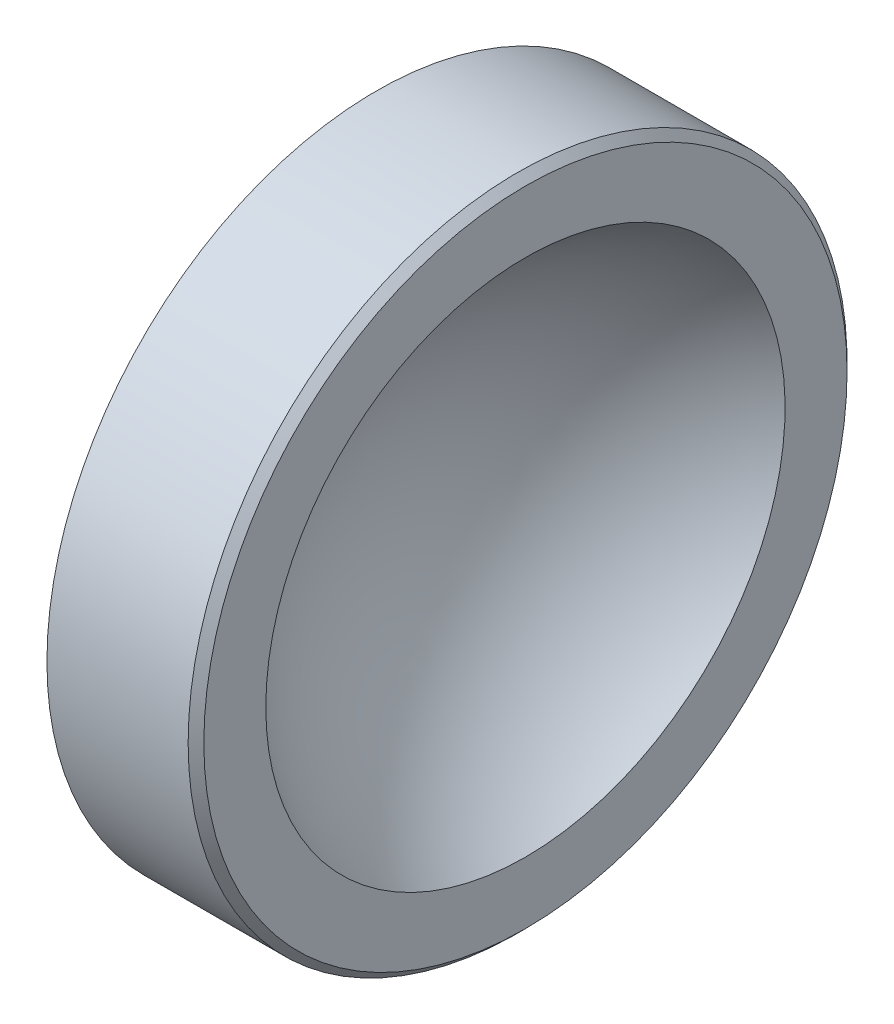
SolidWorks part; units mm, degrees
ref_plane "Front Plane" through (0, 0, 0) normal (0, 0, 1) x (1, 0, 0)
ref_plane "Top Plane" through (0, 0, 0) normal (0, 1, 0) x (1, 0, 0)
ref_plane "Right Plane" through (0, 0, 0) normal (1, 0, 0) x (0, 0, -1)
sketch "Sketch1" plane through (0, 0, 0) normal (0, 0, 1) x (1, 0, 0)
  line L1 (0, 10.5) -> (4.75, 10.5)
  line L2 (4.75, 10.5) -> (4.75, 8.275)
  line L3 (4.75, -10.5) -> (0, -10.5)
  line L5 (4.75, -8.275) -> (4.75, -10.5)
  line L6 (-2.5893, 0) -> (1.663, 0) construction
  arc A0 (0, 10.5) -> (0, -10.5) centre (110, 0) ccw
  arc A1 (4.75, 8.275) -> (4.75, -8.275) centre (9.893, 0) ccw
revolve "Revolve1" add sketch "Sketch1" angle 360 about L6
chamfer "Chamfer1" distance 0.25 angle 45 1 edges at (4.75, 0, 10.5)
